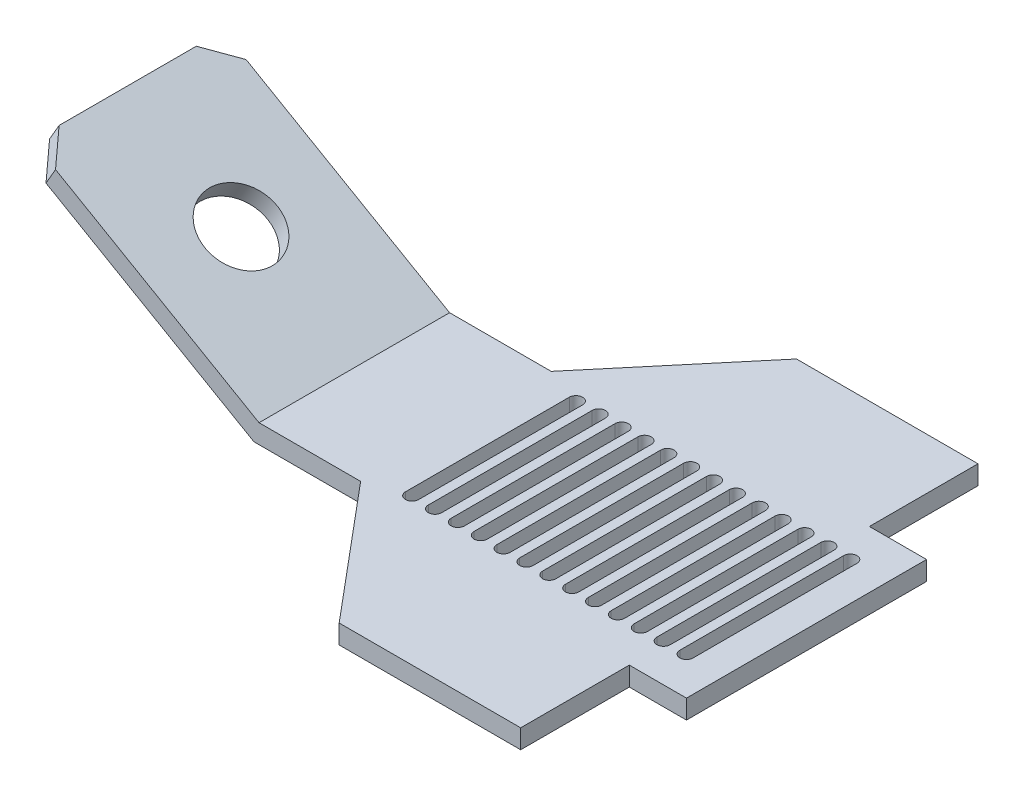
SolidWorks part; units mm, degrees
ref_plane "Front" through (0, 0, 0) normal (0, 0, 1) x (1, 0, 0)
ref_plane "Top" through (0, 0, 0) normal (0, 1, 0) x (1, 0, 0)
ref_plane "Right" through (0, 0, 0) normal (1, 0, 0) x (0, 0, -1)
sketch "Sketch2" plane through (0, 0, 0) normal (0, 1, 0) x (1, 0, 0)
  line L0 (0, 0) -> (-120, 0) construction
  line L1 (0, -31.501) -> (0, 31.501)
  line L2 (0, 31.501) -> (-15, 31.501)
  line L3 (0, -31.501) -> (-15, -31.501)
  line L4 (-15, 31.501) -> (-15, 60)
  line L5 (-15, -31.501) -> (-15, -60)
  line L6 (-15, 60) -> (-62.6315, 60)
  line L7 (-15, -60) -> (-62.6315, -60)
  line L8 (-62.6315, 60) -> (-92, 25)
  line L9 (-62.6315, -60) -> (-92, -25)
  line L10 (-92, 25) -> (-120, 25)
  line L11 (-92, -25) -> (-120, -25)
  line L12 (-120, 25) -> (-120, -25)
  dimension "D1" = 63.0019
  dimension "D2" = 120
  dimension "D3" = 15
  dimension "D4" = 50
  dimension "D5" = 120
  dimension "D6" = 50
  dimension "D7" = 28
extrude "Boss-Extrude1" add sketch "Sketch2" along normal blind 5
sketch "Sketch3" plane through (0, 0, 0) normal (0, 0, 1) x (1, 0, 0)
  line L0 (-120, 0) -> (-180.6218, 35)
  line L1 (-180.6218, 35) -> (-178.1218, 39.3301)
  line L2 (-117.5, 4.3301) -> (-178.1218, 39.3301)
  line L3 (-117.5, 4.3301) -> (-120, 0)
  line L4 (-120, 5) -> (-92, 5) construction
  dimension "D2" = 150
  dimension "D3" = 70
extrude "Boss-Extrude2" add sketch "Sketch3" along normal up to surface and the other way up to surface
sketch "Sketch4" plane through (0, 5, 0) normal (0, 1, 0) x (1, 0, 0)
  line L0 (-10, -21.501) -> (-10, 21.501) construction
  line L1 (-11.75, -21.501) -> (-11.75, 21.501)
  line L2 (-8.25, -21.501) -> (-8.25, 21.501)
  line L5 (0, -31.501) -> (0, 31.501) construction
  line L6 (0, 31.501) -> (-15, 31.501) construction
  arc A0 (-11.75, -21.501) -> (-8.25, -21.501) centre (-10, -21.501) ccw
  arc A1 (-8.25, 21.501) -> (-11.75, 21.501) centre (-10, 21.501) ccw
  point P2 (-10, 0)
  dimension "D1" = 3.5
  dimension "D2" = 10
  dimension "D3" = 10
extrude "Cut-Extrude1" cut sketch "Sketch4" against normal through all
pattern_linear "LPattern1" count 13 spacing 6 along (-1, 0, 0) of "Cut-Extrude1"
sketch "Sketch5" plane through (-27.5, -47.6314, 0) normal (0.5, 0.866, 0) x (0, 0, -1)
  line L0 (0, 105.2628) -> (0, 173.923) construction
  line L1 (25, 105.2628) -> (-25, 105.2628) construction
  line L2 (-25, 173.923) -> (25, 173.923) construction
  circle A0 centre (0, 139.5929) radius 9.5
  dimension "D1" = 19
extrude "Cut-Extrude2" cut sketch "Sketch5" against normal up to next
chamfer "Chamfer1" distance 7 angle 45 2 edges at (-179.3718, 37.1651, 25) (-179.3718, 37.1651, -25)
